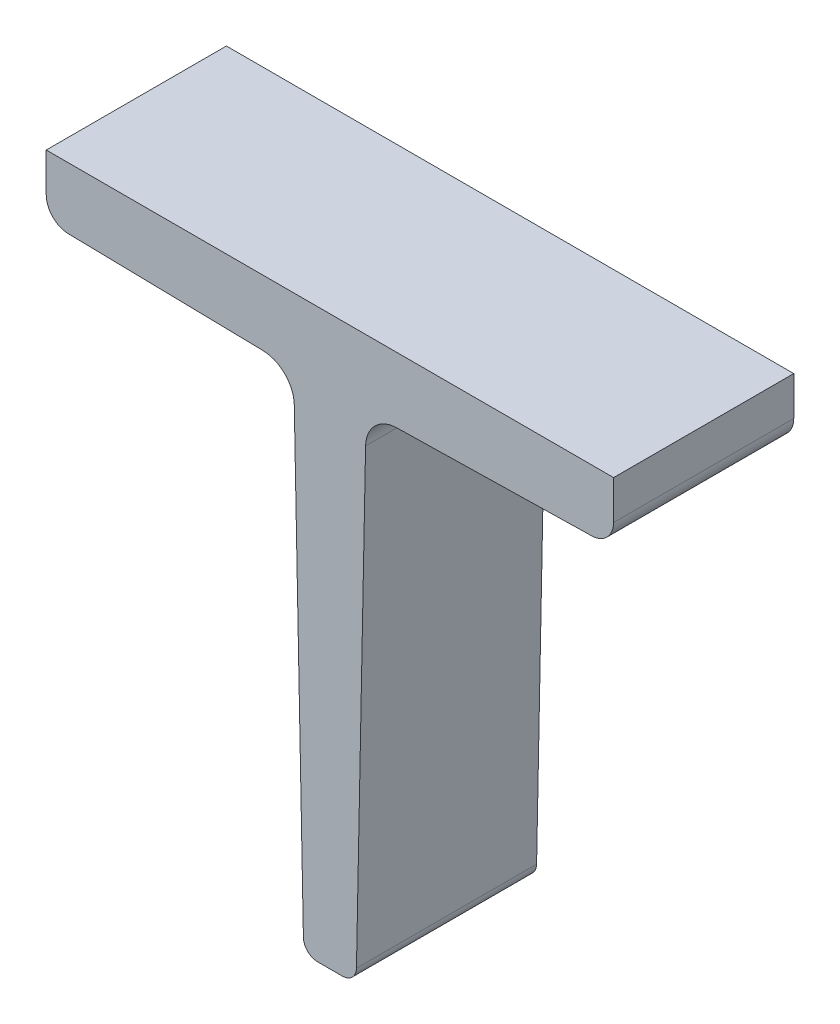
SolidWorks part; units mm, degrees
ref_plane "Plane1" through (0, 0, 0) normal (0, 0, 1) x (1, 0, 0)
ref_plane "Plane2" through (0, 0, 0) normal (0, 1, 0) x (-1, 0, 0)
ref_plane "Plane3" through (0, 0, 0) normal (1, 0, 0) x (0, 0, -1)
sketch "Sketch1" plane through (0, 0, 0) normal (0, 0, 1) x (1, 0, 0)
  line L0 (0, 0) -> (80, 0)
  line L1 (15.6984, 0) -> (-15.6984, 0) construction
  line L2 (36.3002, -80) -> (34.8858, -9.2978)
  line L3 (34.8858, -9.2978) -> (0, -8.5999)
  line L4 (0, -9.8115) -> (0, 9.8115) construction
  line L5 (0, 0) -> (0, -8.5999)
  line L6 (80, 0) -> (80, -8.5999)
  line L7 (80, -8.5999) -> (45.1142, -9.2978)
  line L8 (45.1142, -9.2978) -> (43.6998, -80)
  line L9 (31.75, -9) -> (-6.2843, -9) construction
  line L10 (40, 13.0564) -> (40, -89.9884) construction
  line L11 (24.9399, -40) -> (54.9032, -40) construction
  line L12 (36.3002, -80) -> (43.6998, -80)
  dimension "D3" = 8.5999
  dimension "BF" = 80
  dimension "DEPTH" = 80
  dimension "TF" = 9
  dimension "BF2" = 40
  dimension "D4" = 7.3997
  dimension "Depth2" = 40
extrude "BaseStee" add sketch "Sketch1" along normal mid plane 25.4
fillet "InsideFillet" radius 4.5 2 edges at (34.8858, -9.2978, 0) (45.1142, -9.2978, 0)
fillet "ToeFillet" radius 3.175 2 edges at (0, -8.5999, 0) (80, -8.5999, 0)
fillet "EndFillet" radius 2 2 edges at (43.6998, -80, 0) (36.3002, -80, 0)
equation "\"BF2@Sketch1\" = \"BF@Sketch1\" / 2"
equation "\"Depth2@Sketch1\" = \"DEPTH@Sketch1\" / 2"
equation "\"D3@Sketch1\" = \"TF@Sketch1\" -  ( (  \"BF@Sketch1\" / 4 )  * tan(\"Angle@Sketch1\" / 180 * 3.141592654 )  ) "
equation "\"D4@Sketch1\" = \"TF@Sketch1\" - 2 *  ( \"Depth2@Sketch1\" * tan(\"Angle@Sketch1\" / 180 * 3.141592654 )  ) "
